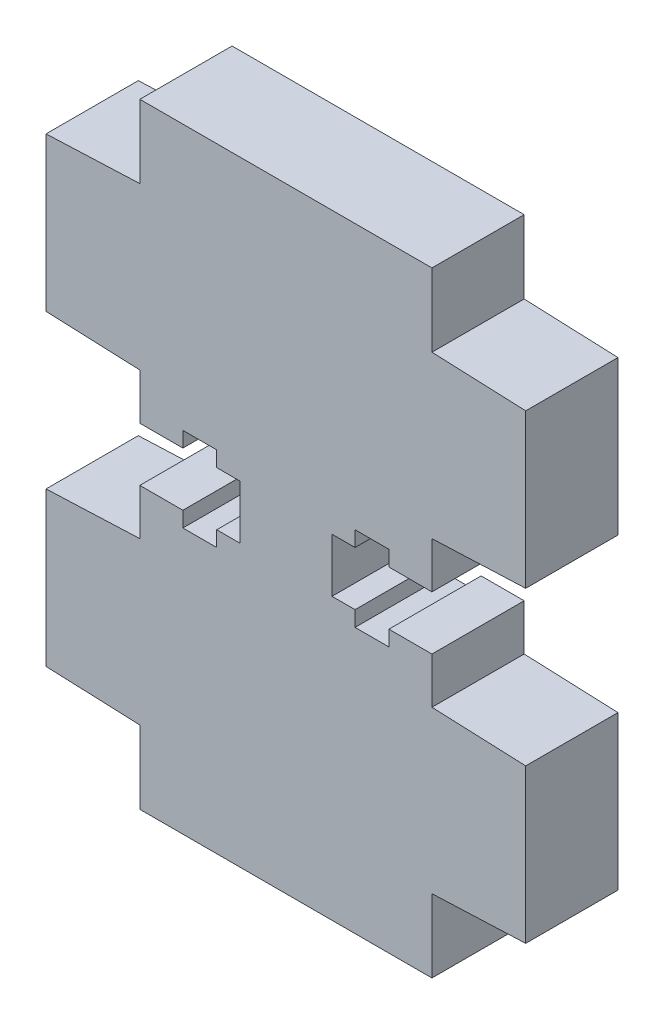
SolidWorks part; units mm, degrees
ref_plane "Спереди" through (0, 0, 0) normal (0, 0, 1) x (1, 0, 0)
ref_plane "Сверху" through (0, 0, 0) normal (0, 1, 0) x (1, 0, 0)
ref_plane "Справа" through (0, 0, 0) normal (1, 0, 0) x (0, 0, -1)
sketch "Эскиз1" plane through (0, 0, 0) normal (0, 0, 1) x (1, 0, 0)
  line L0 (0, 38.3106) -> (0, 0) construction
  line L1 (0, 0) -> (42.6799, 0) construction
  line L2 (0, 20) -> (9.5, 20)
  line L3 (9.5, 20) -> (9.5, 15.25)
  line L4 (9.5, 15.25) -> (15.6, 15)
  line L5 (15.6, 15) -> (15.6, 5)
  line L6 (15.6, 5) -> (9.5, 4.75)
  line L7 (9.5, 4.75) -> (9.5, 1.75)
  line L8 (9.5, 1.75) -> (6.7, 1.75)
  line L9 (6.7, 1.75) -> (6.7, 2.75)
  line L10 (6.7, 2.75) -> (4.5, 2.75)
  line L11 (4.5, 2.75) -> (4.5, 1.75)
  line L12 (4.5, 1.75) -> (3, 1.75)
  line L13 (3, 1.75) -> (3, 0)
  line L14 (15.6, 10) -> (11.5171, 10) construction
  line L15 (0, 20) -> (0, 0)
  line L16 (0, 0) -> (3, 0)
  dimension "D1" = 40
  dimension "D2" = 10
  dimension "D3" = 10.5
  dimension "D4" = 6.5
  dimension "D5" = 1.5
  dimension "D6" = 2.2
  dimension "D7" = 5.5
  dimension "D8" = 3.5
  dimension "D9" = 19
  dimension "D10" = 10
  dimension "D11" = 6.1
extrude "Бобышка-Вытянуть1" add sketch "Эскиз1" along normal blind 6
mirror "Зеркальное отражение1" about plane through (0, 20, 6) normal (1, 0, 0)
mirror "Зеркальное отражение2" about plane through (0, 0, 6) normal (0, 1, 0)
